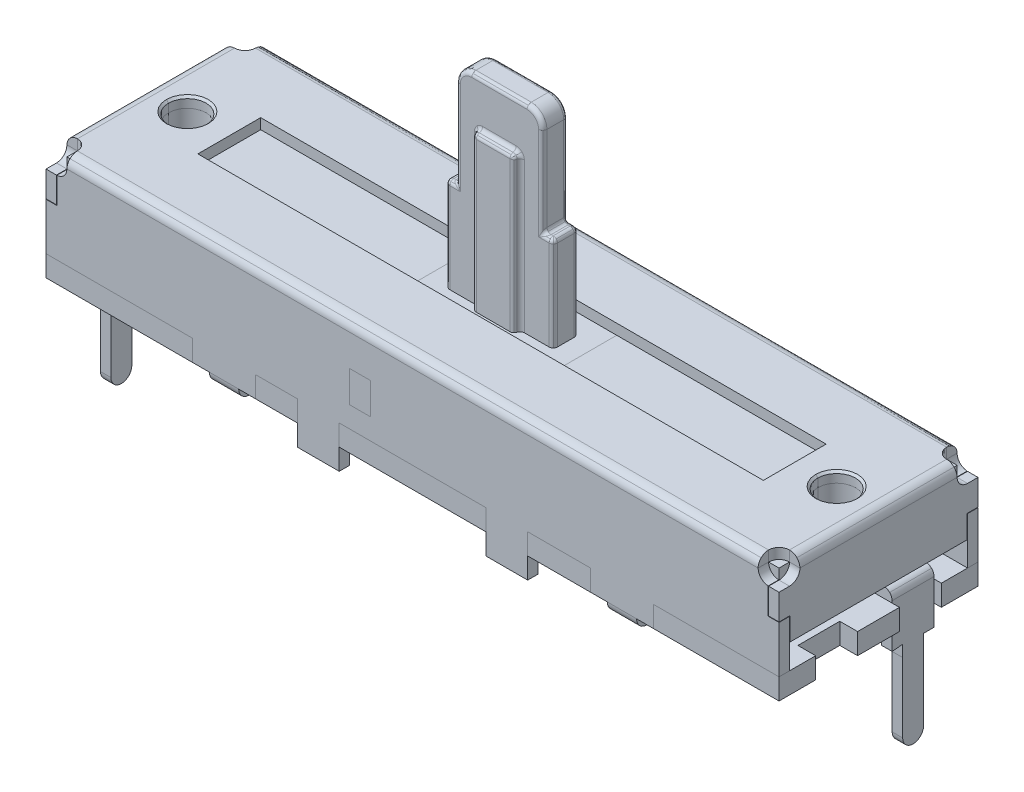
SolidWorks part; units mm, degrees
ref_plane "Front Plane" through (0, 0, 0) normal (0, 0, 1) x (1, 0, 0)
ref_plane "Top Plane" through (0, 0, 0) normal (0, 1, 0) x (1, 0, 0)
ref_plane "Right Plane" through (0, 0, 0) normal (1, 0, 0) x (0, 0, -1)
imported_body "Slide potentiometers.stp<1>"
delete or keep bodies "Body-Delete/Keep 2" type delete bodies bodies 113 111 110 109 108 112
delete or keep bodies "Body-Delete/Keep 3" type delete bodies bodies 114
